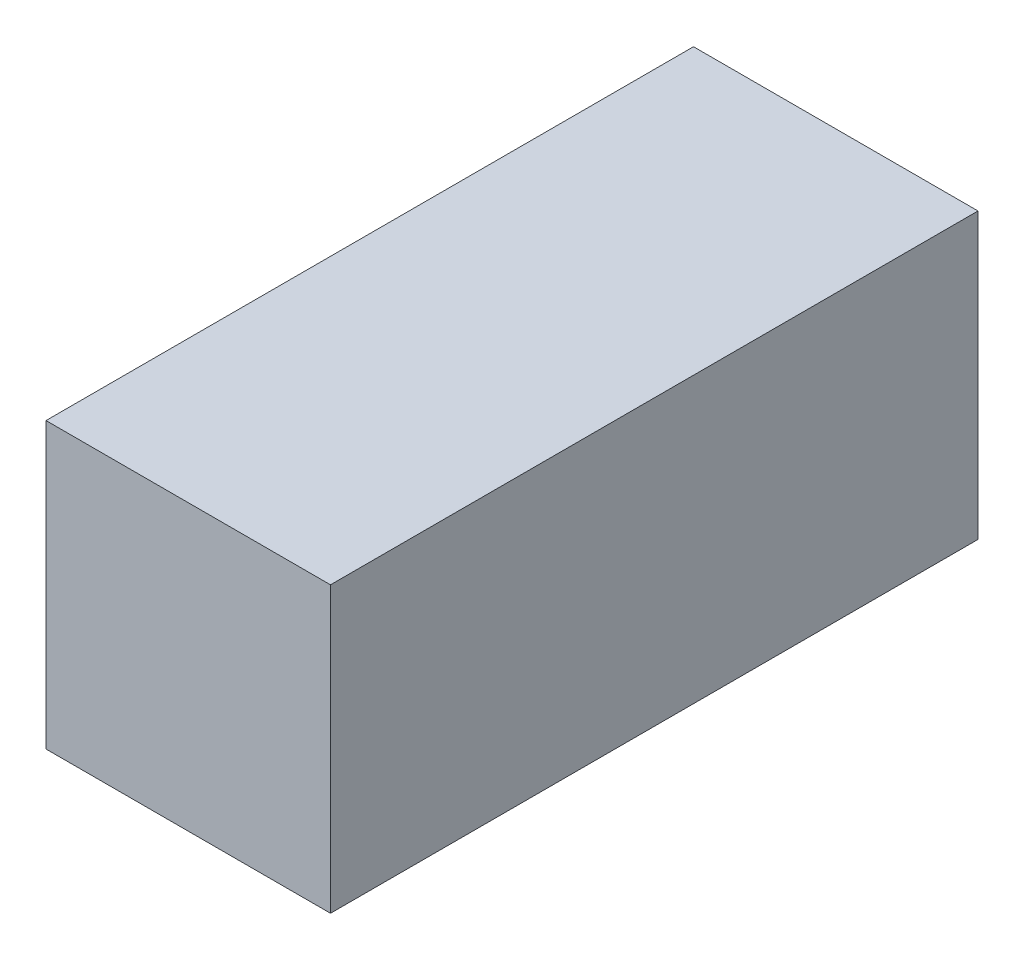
SolidWorks part; units mm, degrees
ref_plane "Front Plane" through (0, 0, 0) normal (0, 0, 1) x (1, 0, 0)
ref_plane "Top Plane" through (0, 0, 0) normal (0, 1, 0) x (1, 0, 0)
ref_plane "Right Plane" through (0, 0, 0) normal (1, 0, 0) x (0, 0, -1)
sketch "Sketch1" plane through (0, 0, 0) normal (0, 0, 1) x (1, 0, 0)
  line L1 (17.018, -17.018) -> (-17.018, -17.018)
  line L2 (17.018, -17.018) -> (17.018, 17.018)
  line L3 (17.018, 17.018) -> (-17.018, 17.018)
  line L4 (-17.018, -17.018) -> (-17.018, 17.018)
  line L5 (17.018, -17.018) -> (-17.018, 17.018) construction
  line L6 (17.018, 17.018) -> (-17.018, -17.018) construction
  point P0 (0, 0)
  dimension "D1" = 34.036
extrude "Boss-Extrude1" add sketch "Sketch1" along normal blind 77.47
